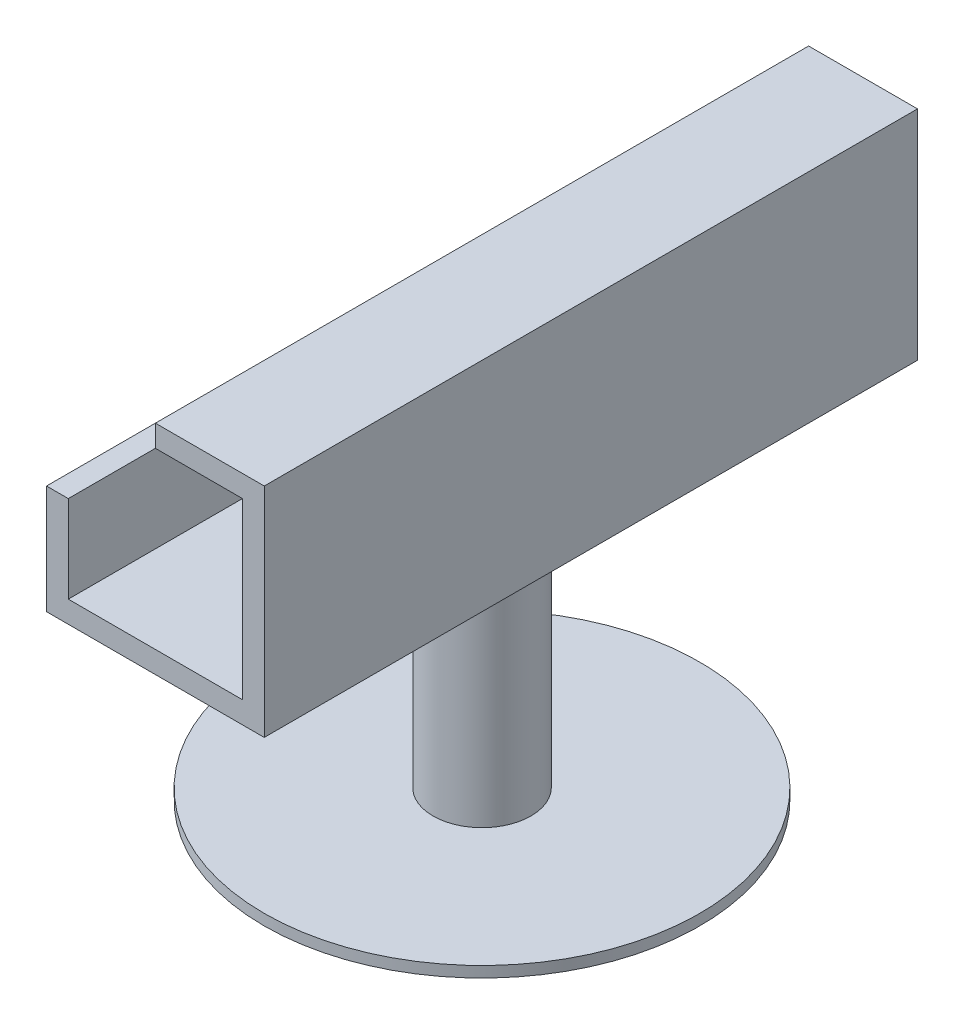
SolidWorks part; units mm, degrees
ref_plane "Plan de face" through (0, 0, 0) normal (0, 0, 1) x (1, 0, 0)
ref_plane "Plan de dessus" through (0, 0, 0) normal (0, 1, 0) x (1, 0, 0)
ref_plane "Plan de droite" through (0, 0, 0) normal (1, 0, 0) x (0, 0, -1)
sketch "Esquisse1" plane through (0, 0, 0) normal (0, 0, 1) x (1, 0, 0)
  line L1 (-16, 16) -> (16, 16)
  line L2 (-16, 16) -> (-16, -16)
  line L3 (-16, -16) -> (16, -16)
  line L4 (16, 16) -> (16, -16)
  line L5 (-20, 20) -> (20, 20)
  line L6 (-20, 20) -> (-20, -20)
  line L7 (-20, -20) -> (20, -20)
  line L8 (20, 20) -> (20, -20)
extrude "Boss.-Extru.1" add sketch "Esquisse1" along normal blind 120
ref_plane "Plan1" through (0, -70, 0) normal (0, 1, 0) x (-1, 0, 0)
sketch "Esquisse2" plane through (0, -70, 0) normal (0, 1, 0) x (-1, 0, 0)
  circle A0 centre (0, 60) radius 40
extrude "Boss.-Extru.2" add sketch "Esquisse2" along normal blind 2
sketch "Esquisse3" plane through (0, -68, 0) normal (0, 1, 0) x (1, 0, 0)
  circle A0 centre (0, -60) radius 9
extrude "Boss.-Extru.3" add sketch "Esquisse3" along normal up to surface (48 mm away)
sketch "Esquisse4" plane through (0, 0, 120) normal (0, 0, 1) x (1, 0, 0)
  line L1 (0, 0) -> (-36.9337, 0)
  line L2 (0, 0) -> (0, 29.3832)
  line L3 (0, 29.3832) -> (-36.9337, 29.3832)
  line L4 (-36.9337, 0) -> (-36.9337, 29.3832)
extrude "Enlèv. mat.-Extru.1" cut sketch "Esquisse4" against normal through all
